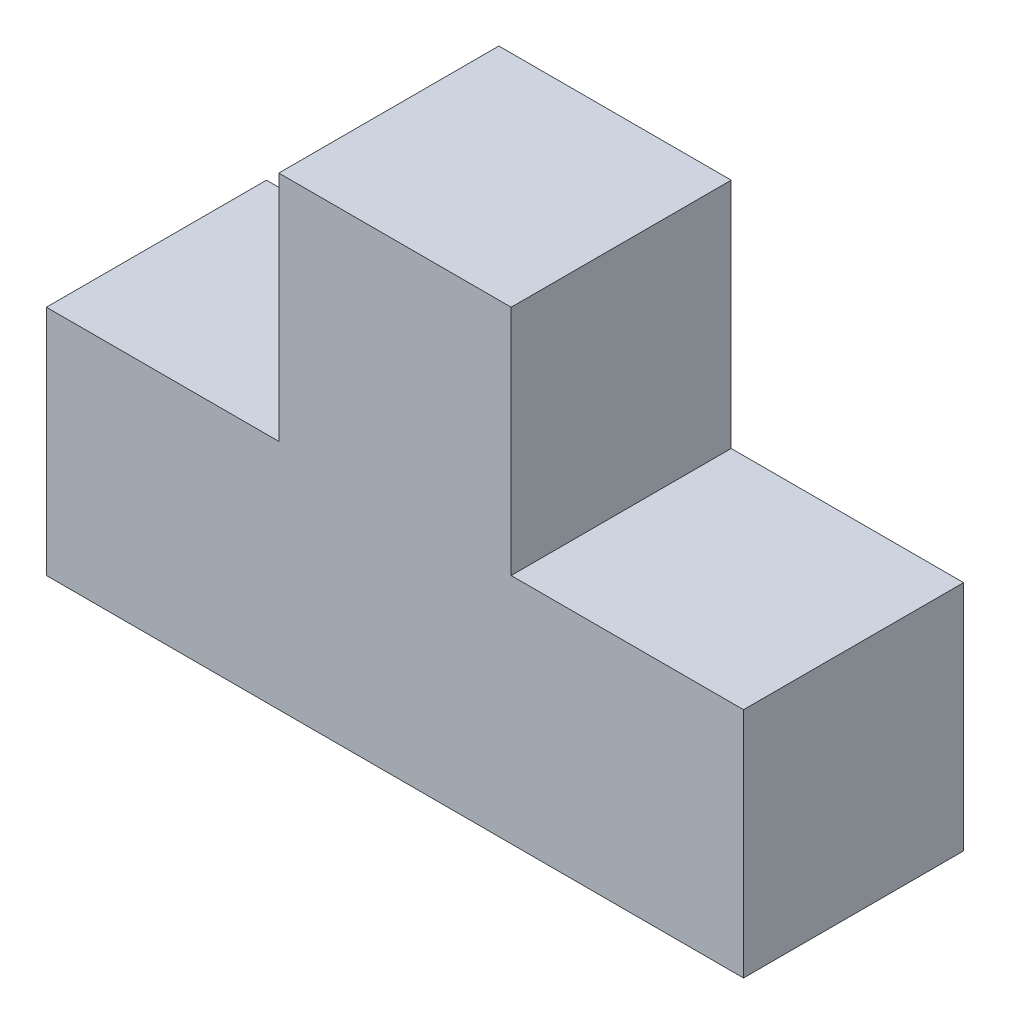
SolidWorks part; units mm, degrees
ref_plane "Front Plane" through (0, 0, 0) normal (0, 0, 1) x (1, 0, 0)
ref_plane "Top Plane" through (0, 0, 0) normal (0, 1, 0) x (1, 0, 0)
ref_plane "Right Plane" through (0, 0, 0) normal (1, 0, 0) x (0, 0, -1)
sketch "Sketch2" plane through (0, 0, 0) normal (0, 0, 1) x (1, 0, 0)
  line L0 (35.9598, 32.7128) -> (35.9598, 64.8979)
  line L1 (35.9598, 64.8979) -> (68.1449, 64.8979)
  line L2 (68.1449, 64.8979) -> (68.1449, 97.083)
  line L3 (68.1449, 97.083) -> (100.33, 97.083)
  line L4 (100.33, 97.083) -> (100.33, 64.8979)
  line L5 (100.33, 64.8979) -> (132.5151, 64.8979)
  line L6 (132.5151, 64.8979) -> (132.5151, 32.7128)
  line L7 (132.5151, 32.7128) -> (35.9598, 32.7128)
extrude "Extrude1" add sketch "Sketch2" against normal blind 30.48
